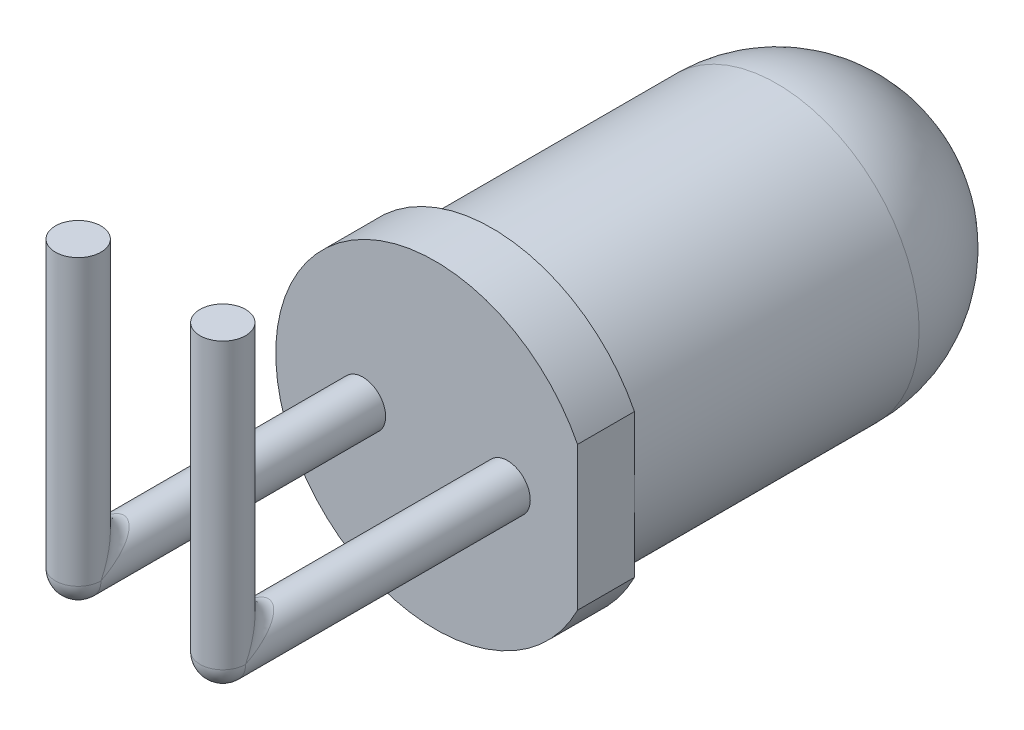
SolidWorks part; units mm, degrees
ref_plane "Face" through (0, 0, 0) normal (0, 0, 1) x (1, 0, 0)
ref_plane "Dessus" through (0, 0, 0) normal (0, 1, 0) x (1, 0, 0)
ref_plane "Droite" through (0, 0, 0) normal (1, 0, 0) x (0, 0, -1)
sketch "Esquisse1" plane through (0, 0, 0) normal (0, 0, 1) x (1, 0, 0)
  circle A0 centre (0, 0) radius 2.5
extrude "Base-Extrusion" add sketch "Esquisse1" along normal blind 8.5
sketch "Esquisse2" plane through (0, 0, 8.5) normal (0, 0, 1) x (1, 0, 0)
  line L0 (2.5, -2.4917) -> (2.5, 2.5621) construction
  line L1 (2.5, 1.261) -> (2.5, -1.261)
  arc A0 (2.5, 1.261) -> (2.5, -1.261) centre (0, 0) ccw
extrude "Boss.-Extru.1" add sketch "Esquisse2" against normal blind 1
fillet "Congé1" radius 2.5 1 edges at (2.5, 0, 0)
sketch "Esquisse3" plane through (0, 0, 8.5) normal (0, 0, 1) x (1, 0, 0)
  line L0 (0, 1.4329) -> (0, -0.9388) construction
  circle A0 centre (1.27, 0) radius 0.4
  circle A1 centre (-1.27, 0) radius 0.4
ref_plane "Plan1" through (0, 0, 0) normal (1, 0, 0) x (0, 0, -1)
sketch "Esquisse4" plane through (0, 0, 0) normal (1, 0, 0) x (0, 0, -1)
  line L0 (-8.5, 0) -> (-13.5, 0)
  line L1 (-8.5, 0.4) -> (-8.5, -0.4) construction
  line L2 (-13.5, 0) -> (-13.5, 5)
  dimension "D1" = 5
  dimension "D2" = 5
sweep "Balayage1" add profiles "Esquisse3" path "Esquisse4"
fillet "Congé2" radius 0.4 2 edges at (1.27, 0.4, 13.1) (-1.27, 0.4, 13.1)
